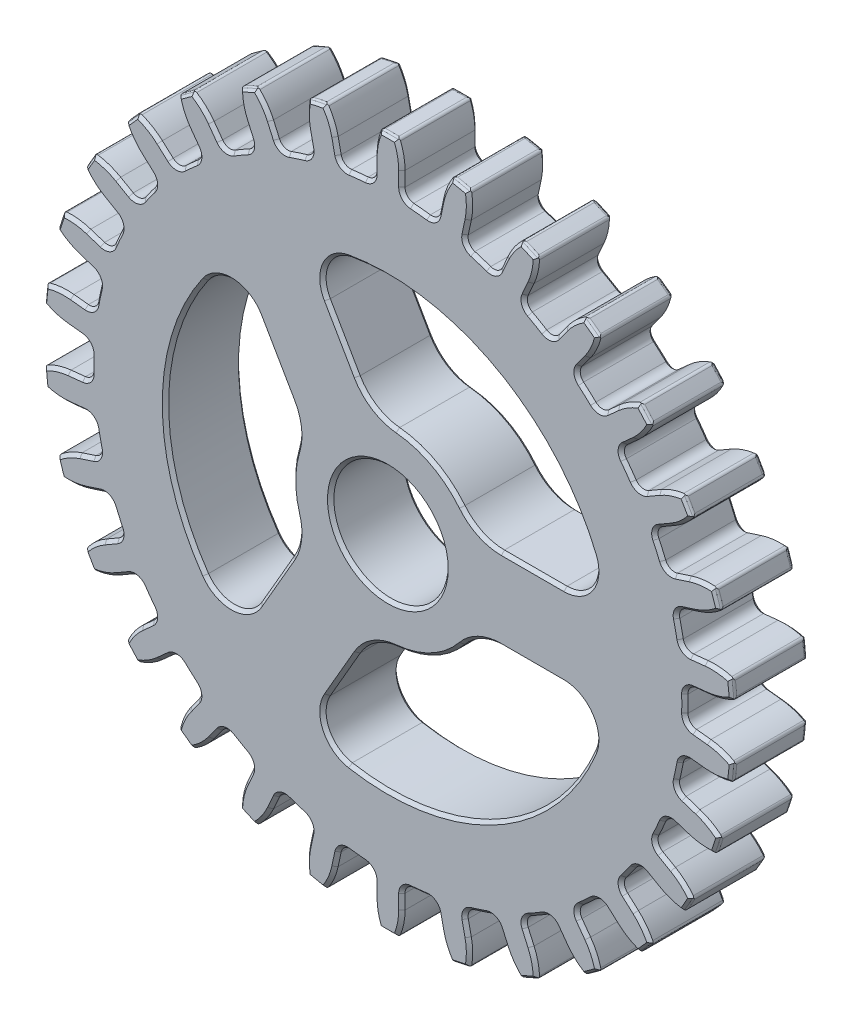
SolidWorks part; units mm, degrees
ref_plane "Спереди" through (0, 0, 0) normal (0, 0, 1) x (1, 0, 0)
ref_plane "Сверху" through (0, 0, 0) normal (0, 1, 0) x (1, 0, 0)
ref_plane "Справа" through (0, 0, 0) normal (1, 0, 0) x (0, 0, -1)
sketch "Эскиз1" plane through (0, 0, 0) normal (0, 0, 1) x (1, 0, 0)
  line L0 (0, 0) -> (27.2, 0) construction
  line L1 (0, 0) -> (0, 27.2) construction
  line L2 (8.9268, 3.25) -> (13.8542, 3.25)
  line L3 (8.9268, -3.25) -> (13.8542, -3.25)
  line L4 (-2.4255, -9.453) -> (-4.7744, -13.5213)
  line L5 (-7.5458, -5.3215) -> (-10.1442, -9.8222)
  line L6 (-7.5458, 5.3215) -> (-10.1442, 9.8222)
  line L7 (-2.4255, 9.453) -> (-4.7744, 13.5213)
  line L8 (0, 0) -> (-13.6, 23.5559) construction
  line L9 (-1.1, 25.2) -> (-1.1, 24.054)
  line L10 (1.1, 25.2) -> (1.1, 24.054)
  line L11 (4.1634, 24.878) -> (3.9251, 23.757)
  line L12 (6.3153, 24.4206) -> (6.0771, 23.2996)
  line L13 (9.2449, 23.4688) -> (8.7787, 22.4218)
  line L14 (11.2547, 22.5739) -> (10.7885, 21.527)
  line L15 (13.9223, 21.0338) -> (13.2486, 20.1066)
  line L16 (15.7021, 19.7407) -> (15.0285, 18.8135)
  line L17 (17.9912, 17.6796) -> (17.1395, 16.9127)
  line L18 (19.4633, 16.0446) -> (18.6116, 15.2778)
  line L19 (21.2738, 13.5526) -> (20.2813, 12.9796)
  line L20 (22.3738, 11.6474) -> (21.3813, 11.0744)
  line L21 (23.6267, 8.8334) -> (22.5368, 8.4792)
  line L22 (24.3065, 6.7411) -> (23.2166, 6.3869)
  line L23 (24.947, 3.7281) -> (23.8072, 3.6083)
  line L24 (25.1769, 1.5401) -> (24.0372, 1.4203)
  line L25 (25.1769, -1.5401) -> (24.0372, -1.4203)
  line L26 (24.947, -3.7281) -> (23.8072, -3.6083)
  line L27 (24.3065, -6.7411) -> (23.2166, -6.3869)
  line L28 (23.6267, -8.8334) -> (22.5368, -8.4792)
  line L29 (22.3738, -11.6474) -> (21.3813, -11.0744)
  line L30 (21.2738, -13.5526) -> (20.2813, -12.9796)
  line L31 (19.4633, -16.0446) -> (18.6116, -15.2778)
  line L32 (17.9912, -17.6796) -> (17.1395, -16.9127)
  line L33 (15.7021, -19.7407) -> (15.0285, -18.8135)
  line L34 (13.9223, -21.0338) -> (13.2486, -20.1066)
  line L35 (11.2547, -22.5739) -> (10.7885, -21.527)
  line L36 (9.2449, -23.4688) -> (8.7787, -22.4218)
  line L37 (6.3153, -24.4206) -> (6.0771, -23.2996)
  line L38 (4.1634, -24.878) -> (3.9251, -23.757)
  line L39 (1.1, -25.2) -> (1.1, -24.054)
  line L40 (-1.1, -25.2) -> (-1.1, -24.054)
  line L41 (-4.1634, -24.878) -> (-3.9251, -23.757)
  line L42 (-6.3153, -24.4206) -> (-6.0771, -23.2996)
  line L43 (-9.2449, -23.4688) -> (-8.7787, -22.4218)
  line L44 (-11.2547, -22.5739) -> (-10.7885, -21.527)
  line L45 (-13.9223, -21.0338) -> (-13.2486, -20.1066)
  line L46 (-15.7021, -19.7407) -> (-15.0285, -18.8135)
  line L47 (-17.9912, -17.6796) -> (-17.1395, -16.9127)
  line L48 (-19.4633, -16.0446) -> (-18.6116, -15.2778)
  line L49 (-21.2738, -13.5526) -> (-20.2813, -12.9796)
  line L50 (-22.3738, -11.6474) -> (-21.3813, -11.0744)
  line L51 (-23.6267, -8.8334) -> (-22.5368, -8.4792)
  line L52 (-24.3065, -6.7411) -> (-23.2166, -6.3869)
  line L53 (-24.947, -3.7281) -> (-23.8072, -3.6083)
  line L54 (-25.1769, -1.5401) -> (-24.0372, -1.4203)
  line L55 (-25.1769, 1.5401) -> (-24.0372, 1.4203)
  line L56 (-24.947, 3.7281) -> (-23.8072, 3.6083)
  line L57 (-24.3065, 6.7411) -> (-23.2166, 6.3869)
  line L58 (-23.6267, 8.8334) -> (-22.5368, 8.4792)
  line L59 (-22.3738, 11.6474) -> (-21.3813, 11.0744)
  line L60 (-21.2738, 13.5526) -> (-20.2813, 12.9796)
  line L61 (-19.4633, 16.0446) -> (-18.6116, 15.2778)
  line L62 (-17.9912, 17.6796) -> (-17.1395, 16.9127)
  line L63 (-15.7021, 19.7407) -> (-15.0285, 18.8135)
  line L64 (-13.9223, 21.0338) -> (-13.2486, 20.1066)
  line L65 (-11.2547, 22.5739) -> (-10.7885, 21.527)
  line L66 (-9.2449, 23.4688) -> (-8.7787, 22.4218)
  line L67 (-6.3153, 24.4206) -> (-6.0771, 23.2996)
  line L68 (-4.1634, 24.878) -> (-3.9251, 23.757)
  arc A0 (-13.6, 23.5559) -> (27.1141, -2.1597) centre (0, 0) ccw
  circle A1 centre (0, 0) radius 25.5 construction
  arc A2 (-1.7925, 23.3062) -> (-3.0923, 23.1696) centre (0, 0) ccw
  circle A3 centre (0, 0) radius 4.5
  arc A4 (5.8218, 4.7283) -> (0.6773, 7.4694) centre (0, 0) ccw
  arc A5 (16.1632, 6.7083) -> (-3.0442, 17.2332) centre (0, 0) ccw
  arc A6 (-14.3608, 10.0008) -> (-14.3608, -10.0008) centre (0, 0) ccw
  arc A7 (-3.0442, -17.2332) -> (16.1632, -6.7083) centre (0, 0) ccw
  arc A8 (0.6773, -7.4694) -> (5.8218, -4.7283) centre (0, 0) ccw
  arc A9 (-7.1804, 2.1662) -> (-7.1804, -2.1662) centre (0, 0) ccw
  arc A10 (-7.5458, 5.3215) -> (-7.1804, 2.1662) centre (-11.0099, 3.3215) cw
  arc A11 (-7.5458, -5.3215) -> (-7.1804, -2.1662) centre (-11.0099, -3.3215) ccw
  arc A12 (-2.4255, -9.453) -> (0.6773, -7.4694) centre (1.0386, -11.453) cw
  arc A13 (8.9268, -3.25) -> (5.8218, -4.7283) centre (8.9268, -7.25) ccw
  arc A14 (8.9268, 3.25) -> (5.8218, 4.7283) centre (8.9268, 7.25) cw
  arc A15 (-2.4255, 9.453) -> (0.6773, 7.4694) centre (1.0386, 11.453) ccw
  arc A16 (-10.1442, -9.8222) -> (-14.3608, -10.0008) centre (-12.3093, -8.5722) cw
  arc A17 (-4.7744, -13.5213) -> (-3.0442, -17.2332) centre (-2.6093, -14.7713) ccw
  arc A18 (13.8542, -3.25) -> (16.1632, -6.7083) centre (13.8542, -5.75) cw
  arc A19 (13.8542, 3.25) -> (16.1632, 6.7083) centre (13.8542, 5.75) ccw
  arc A20 (-4.7744, 13.5213) -> (-3.0442, 17.2332) centre (-2.6093, 14.7713) cw
  arc A21 (-10.1442, 9.8222) -> (-14.3608, 10.0008) centre (-12.3093, 8.5722) ccw
  arc A22 (-0.6863, 27.1913) -> (-1.1, 25.2) centre (3.9, 25.2) ccw
  arc A23 (0.6863, 27.1913) -> (1.1, 25.2) centre (-3.9, 25.2) cw
  arc A24 (0.6863, 27.1913) -> (-0.6863, 27.1913) centre (0, 0) ccw
  arc A25 (4.982, 26.7398) -> (4.1634, 24.878) centre (9.0542, 23.8385) ccw
  arc A26 (6.3247, 26.4544) -> (4.982, 26.7398) centre (0, 0) ccw
  arc A27 (6.3247, 26.4544) -> (6.3153, 24.4206) centre (1.4246, 25.4602) cw
  arc A28 (10.4327, 25.1197) -> (9.2449, 23.4688) centre (13.8126, 21.4351) ccw
  arc A29 (11.6867, 24.5614) -> (10.4327, 25.1197) centre (0, 0) ccw
  arc A30 (11.6867, 24.5614) -> (11.2547, 22.5739) centre (6.6869, 24.6076) cw
  arc A31 (15.4274, 22.4017) -> (13.9223, 21.0338) centre (17.9674, 18.0949) ccw
  arc A32 (16.5379, 21.5948) -> (15.4274, 22.4017) centre (0, 0) ccw
  arc A33 (16.5379, 21.5948) -> (15.7021, 19.7407) centre (11.657, 22.6796) cw
  arc A34 (19.7478, 18.7046) -> (17.9912, 17.6796) centre (21.3369, 13.9638) ccw
  arc A35 (20.6664, 17.6845) -> (19.7478, 18.7046) centre (0, 0) ccw
  arc A36 (20.6664, 17.6845) -> (19.4633, 16.0446) centre (16.1176, 19.7604) cw
  arc A37 (23.2052, 14.1901) -> (21.2738, 13.5526) centre (23.7738, 9.2225) ccw
  arc A38 (23.8916, 13.0013) -> (23.2052, 14.1901) centre (0, 0) ccw
  arc A39 (23.8916, 13.0013) -> (22.3738, 11.6474) centre (19.8738, 15.9775) cw
  arc A40 (25.6484, 9.0553) -> (23.6267, 8.8334) centre (25.1718, 4.0781) ccw
  arc A41 (26.0726, 7.7498) -> (25.6484, 9.0553) centre (0, 0) ccw
  arc A42 (26.0726, 7.7498) -> (24.3065, 6.7411) centre (22.7615, 11.4963) cw
  arc A43 (26.9706, 3.5249) -> (24.947, 3.7281) centre (25.4696, -1.2445) ccw
  arc A44 (27.1141, 2.1597) -> (26.9706, 3.5249) centre (0, 0) ccw
  arc A45 (27.1141, 2.1597) -> (25.1769, 1.5401) centre (24.6543, 6.5128) cw
  arc A46 (27.1141, -2.1597) -> (25.1769, -1.5401) centre (24.6543, -6.5128) ccw
  arc A47 (26.9706, -3.5249) -> (27.1141, -2.1597) centre (0, 0) ccw
  arc A48 (26.9706, -3.5249) -> (24.947, -3.7281) centre (25.4696, 1.2445) cw
  arc A49 (26.0726, -7.7498) -> (24.3065, -6.7411) centre (22.7615, -11.4963) ccw
  arc A50 (25.6484, -9.0553) -> (26.0726, -7.7498) centre (0, 0) ccw
  arc A51 (25.6484, -9.0553) -> (23.6267, -8.8334) centre (25.1718, -4.0781) cw
  arc A52 (23.8916, -13.0013) -> (22.3738, -11.6474) centre (19.8738, -15.9775) ccw
  arc A53 (23.2052, -14.1901) -> (23.8916, -13.0013) centre (0, 0) ccw
  arc A54 (23.2052, -14.1901) -> (21.2738, -13.5526) centre (23.7738, -9.2225) cw
  arc A55 (20.6664, -17.6845) -> (19.4633, -16.0446) centre (16.1176, -19.7604) ccw
  arc A56 (19.7478, -18.7046) -> (20.6664, -17.6845) centre (0, 0) ccw
  arc A57 (19.7478, -18.7046) -> (17.9912, -17.6796) centre (21.3369, -13.9638) cw
  arc A58 (16.5379, -21.5948) -> (15.7021, -19.7407) centre (11.657, -22.6796) ccw
  arc A59 (15.4274, -22.4017) -> (16.5379, -21.5948) centre (0, 0) ccw
  arc A60 (15.4274, -22.4017) -> (13.9223, -21.0338) centre (17.9674, -18.0949) cw
  arc A61 (11.6867, -24.5614) -> (11.2547, -22.5739) centre (6.6869, -24.6076) ccw
  arc A62 (10.4327, -25.1197) -> (11.6867, -24.5614) centre (0, 0) ccw
  arc A63 (10.4327, -25.1197) -> (9.2449, -23.4688) centre (13.8126, -21.4351) cw
  arc A64 (6.3247, -26.4544) -> (6.3153, -24.4206) centre (1.4246, -25.4602) ccw
  arc A65 (4.982, -26.7398) -> (6.3247, -26.4544) centre (0, 0) ccw
  arc A66 (4.982, -26.7398) -> (4.1634, -24.878) centre (9.0542, -23.8385) cw
  arc A67 (0.6863, -27.1913) -> (1.1, -25.2) centre (-3.9, -25.2) ccw
  arc A68 (-0.6863, -27.1913) -> (0.6863, -27.1913) centre (0, 0) ccw
  arc A69 (-0.6863, -27.1913) -> (-1.1, -25.2) centre (3.9, -25.2) cw
  arc A70 (-4.982, -26.7398) -> (-4.1634, -24.878) centre (-9.0542, -23.8385) ccw
  arc A71 (-6.3247, -26.4544) -> (-4.982, -26.7398) centre (0, 0) ccw
  arc A72 (-6.3247, -26.4544) -> (-6.3153, -24.4206) centre (-1.4246, -25.4602) cw
  arc A73 (-10.4327, -25.1197) -> (-9.2449, -23.4688) centre (-13.8126, -21.4351) ccw
  arc A74 (-11.6867, -24.5614) -> (-10.4327, -25.1197) centre (0, 0) ccw
  arc A75 (-11.6867, -24.5614) -> (-11.2547, -22.5739) centre (-6.6869, -24.6076) cw
  arc A76 (-15.4274, -22.4017) -> (-13.9223, -21.0338) centre (-17.9674, -18.0949) ccw
  arc A77 (-16.5379, -21.5948) -> (-15.4274, -22.4017) centre (0, 0) ccw
  arc A78 (-16.5379, -21.5948) -> (-15.7021, -19.7407) centre (-11.657, -22.6796) cw
  arc A79 (-19.7478, -18.7046) -> (-17.9912, -17.6796) centre (-21.3369, -13.9638) ccw
  arc A80 (-20.6664, -17.6845) -> (-19.7478, -18.7046) centre (0, 0) ccw
  arc A81 (-20.6664, -17.6845) -> (-19.4633, -16.0446) centre (-16.1176, -19.7604) cw
  arc A82 (-23.2052, -14.1901) -> (-21.2738, -13.5526) centre (-23.7738, -9.2225) ccw
  arc A83 (-23.8916, -13.0013) -> (-23.2052, -14.1901) centre (0, 0) ccw
  arc A84 (-23.8916, -13.0013) -> (-22.3738, -11.6474) centre (-19.8738, -15.9775) cw
  arc A85 (-25.6484, -9.0553) -> (-23.6267, -8.8334) centre (-25.1718, -4.0781) ccw
  arc A86 (-26.0726, -7.7498) -> (-25.6484, -9.0553) centre (0, 0) ccw
  arc A87 (-26.0726, -7.7498) -> (-24.3065, -6.7411) centre (-22.7615, -11.4963) cw
  arc A88 (-26.9706, -3.5249) -> (-24.947, -3.7281) centre (-25.4696, 1.2445) ccw
  arc A89 (-27.1141, -2.1597) -> (-26.9706, -3.5249) centre (0, 0) ccw
  arc A90 (-27.1141, -2.1597) -> (-25.1769, -1.5401) centre (-24.6543, -6.5128) cw
  arc A91 (-27.1141, 2.1597) -> (-25.1769, 1.5401) centre (-24.6543, 6.5128) ccw
  arc A92 (-26.9706, 3.5249) -> (-27.1141, 2.1597) centre (0, 0) ccw
  arc A93 (-26.9706, 3.5249) -> (-24.947, 3.7281) centre (-25.4696, -1.2445) cw
  arc A94 (-26.0726, 7.7498) -> (-24.3065, 6.7411) centre (-22.7615, 11.4963) ccw
  arc A95 (-25.6484, 9.0553) -> (-26.0726, 7.7498) centre (0, 0) ccw
  arc A96 (-25.6484, 9.0553) -> (-23.6267, 8.8334) centre (-25.1718, 4.0781) cw
  arc A97 (-23.8916, 13.0013) -> (-22.3738, 11.6474) centre (-19.8738, 15.9775) ccw
  arc A98 (-23.2052, 14.1901) -> (-23.8916, 13.0013) centre (0, 0) ccw
  arc A99 (-23.2052, 14.1901) -> (-21.2738, 13.5526) centre (-23.7738, 9.2225) cw
  arc A100 (-20.6664, 17.6845) -> (-19.4633, 16.0446) centre (-16.1176, 19.7604) ccw
  arc A101 (-19.7478, 18.7046) -> (-20.6664, 17.6845) centre (0, 0) ccw
  arc A102 (-19.7478, 18.7046) -> (-17.9912, 17.6796) centre (-21.3369, 13.9638) cw
  arc A103 (-16.5379, 21.5948) -> (-15.7021, 19.7407) centre (-11.657, 22.6796) ccw
  arc A104 (-15.4274, 22.4017) -> (-16.5379, 21.5948) centre (0, 0) ccw
  arc A105 (-15.4274, 22.4017) -> (-13.9223, 21.0338) centre (-17.9674, 18.0949) cw
  arc A106 (-11.6867, 24.5614) -> (-11.2547, 22.5739) centre (-6.6869, 24.6076) ccw
  arc A107 (-10.4327, 25.1197) -> (-11.6867, 24.5614) centre (0, 0) ccw
  arc A108 (-10.4327, 25.1197) -> (-9.2449, 23.4688) centre (-13.8126, 21.4351) cw
  arc A109 (-6.3247, 26.4544) -> (-6.3153, 24.4206) centre (-1.4246, 25.4602) ccw
  arc A110 (-4.982, 26.7398) -> (-6.3247, 26.4544) centre (0, 0) ccw
  arc A111 (-4.982, 26.7398) -> (-4.1634, 24.878) centre (-9.0542, 23.8385) cw
  arc A112 (3.0923, 23.1696) -> (1.7925, 23.3062) centre (0, 0) ccw
  arc A113 (-6.5989, 22.4242) -> (-7.842, 22.0203) centre (0, 0) ccw
  arc A114 (-11.117, 20.5622) -> (-12.2489, 19.9087) centre (0, 0) ccw
  arc A115 (7.842, 22.0203) -> (6.5989, 22.4242) centre (0, 0) ccw
  arc A116 (12.2489, 19.9087) -> (11.117, 20.5622) centre (0, 0) ccw
  arc A117 (16.1205, 16.9269) -> (15.1492, 17.8015) centre (0, 0) ccw
  arc A118 (19.2875, 13.2054) -> (18.5193, 14.2628) centre (0, 0) ccw
  arc A119 (21.6116, 8.9068) -> (21.08, 10.1007) centre (0, 0) ccw
  arc A120 (22.9911, 4.2188) -> (22.7194, 5.4972) centre (0, 0) ccw
  arc A121 (23.3659, -0.6535) -> (23.3659, 0.6535) centre (0, 0) ccw
  arc A122 (22.7194, -5.4972) -> (22.9911, -4.2188) centre (0, 0) ccw
  arc A123 (21.08, -10.1007) -> (21.6116, -8.9068) centre (0, 0) ccw
  arc A124 (18.5193, -14.2628) -> (19.2875, -13.2054) centre (0, 0) ccw
  arc A125 (15.1492, -17.8015) -> (16.1205, -16.9269) centre (0, 0) ccw
  arc A126 (11.117, -20.5622) -> (12.2489, -19.9087) centre (0, 0) ccw
  arc A127 (6.5989, -22.4242) -> (7.842, -22.0203) centre (0, 0) ccw
  arc A128 (1.7925, -23.3062) -> (3.0923, -23.1696) centre (0, 0) ccw
  arc A129 (-3.0923, -23.1696) -> (-1.7925, -23.3062) centre (0, 0) ccw
  arc A130 (-7.842, -22.0203) -> (-6.5989, -22.4242) centre (0, 0) ccw
  arc A131 (-12.2489, -19.9087) -> (-11.117, -20.5622) centre (0, 0) ccw
  arc A132 (-16.1205, -16.9269) -> (-15.1492, -17.8015) centre (0, 0) ccw
  arc A133 (-19.2875, -13.2054) -> (-18.5193, -14.2628) centre (0, 0) ccw
  arc A134 (-21.6116, -8.9068) -> (-21.08, -10.1007) centre (0, 0) ccw
  arc A135 (-22.9911, -4.2188) -> (-22.7194, -5.4972) centre (0, 0) ccw
  arc A136 (-23.3659, 0.6535) -> (-23.3659, -0.6535) centre (0, 0) ccw
  arc A137 (-22.7194, 5.4972) -> (-22.9911, 4.2188) centre (0, 0) ccw
  arc A138 (-21.08, 10.1007) -> (-21.6116, 8.9068) centre (0, 0) ccw
  arc A139 (-18.5193, 14.2628) -> (-19.2875, 13.2054) centre (0, 0) ccw
  arc A140 (-15.1492, 17.8015) -> (-16.1205, 16.9269) centre (0, 0) ccw
  arc A141 (23.8072, 3.6083) -> (22.9911, 4.2188) centre (23.7288, 4.3542) cw
  arc A142 (23.2166, 6.3869) -> (22.7194, 5.4972) centre (23.4484, 5.6736) ccw
  arc A143 (24.0372, 1.4203) -> (23.3659, 0.6535) centre (24.1156, 0.6745) ccw
  arc A144 (24.0372, -1.4203) -> (23.3659, -0.6535) centre (24.1156, -0.6745) cw
  arc A145 (23.2166, -6.3869) -> (22.7194, -5.4972) centre (23.4484, -5.6736) cw
  arc A146 (23.8072, -3.6083) -> (22.9911, -4.2188) centre (23.7288, -4.3542) ccw
  arc A147 (22.5368, -8.4792) -> (21.6116, -8.9068) centre (22.305, -9.1925) ccw
  arc A148 (21.3813, -11.0744) -> (21.08, -10.1007) centre (21.7563, -10.4248) cw
  arc A149 (20.2813, -12.9796) -> (19.2875, -13.2054) centre (19.9063, -13.6291) ccw
  arc A150 (18.6116, -15.2778) -> (18.5193, -14.2628) centre (19.1135, -14.7204) cw
  arc A151 (15.0285, -18.8135) -> (15.1492, -17.8015) centre (15.6352, -18.3727) cw
  arc A152 (17.1395, -16.9127) -> (16.1205, -16.9269) centre (16.6377, -17.4701) ccw
  arc A153 (13.2486, -20.1066) -> (12.2489, -19.9087) centre (12.6419, -20.5475) ccw
  arc A154 (10.7885, -21.527) -> (11.117, -20.5622) centre (11.4737, -21.2219) cw
  arc A155 (8.7787, -22.4218) -> (7.842, -22.0203) centre (8.0936, -22.7269) ccw
  arc A156 (6.0771, -23.2996) -> (6.5989, -22.4242) centre (6.8107, -23.1437) cw
  arc A157 (3.9251, -23.757) -> (3.0923, -23.1696) centre (3.1915, -23.913) ccw
  arc A158 (1.1, -24.054) -> (1.7925, -23.3062) centre (1.85, -24.054) cw
  arc A159 (-1.1, -24.054) -> (-1.7925, -23.3062) centre (-1.85, -24.054) ccw
  arc A160 (-3.9251, -23.757) -> (-3.0923, -23.1696) centre (-3.1915, -23.913) cw
  arc A161 (-6.0771, -23.2996) -> (-6.5989, -22.4242) centre (-6.8107, -23.1437) ccw
  arc A162 (-8.7787, -22.4218) -> (-7.842, -22.0203) centre (-8.0936, -22.7269) cw
  arc A163 (-10.7885, -21.527) -> (-11.117, -20.5622) centre (-11.4737, -21.2219) ccw
  arc A164 (-13.2486, -20.1066) -> (-12.2489, -19.9087) centre (-12.6419, -20.5475) cw
  arc A165 (-15.0285, -18.8135) -> (-15.1492, -17.8015) centre (-15.6352, -18.3727) ccw
  arc A166 (-17.1395, -16.9127) -> (-16.1205, -16.9269) centre (-16.6377, -17.4701) cw
  arc A167 (-18.6116, -15.2778) -> (-18.5193, -14.2628) centre (-19.1135, -14.7204) ccw
  arc A168 (-20.2813, -12.9796) -> (-19.2875, -13.2054) centre (-19.9063, -13.6291) cw
  arc A169 (-21.3813, -11.0744) -> (-21.08, -10.1007) centre (-21.7563, -10.4248) ccw
  arc A170 (-22.5368, -8.4792) -> (-21.6116, -8.9068) centre (-22.305, -9.1925) cw
  arc A171 (-23.2166, -6.3869) -> (-22.7194, -5.4972) centre (-23.4484, -5.6736) ccw
  arc A172 (-23.8072, -3.6083) -> (-22.9911, -4.2188) centre (-23.7288, -4.3542) cw
  arc A173 (-24.0372, -1.4203) -> (-23.3659, -0.6535) centre (-24.1156, -0.6745) ccw
  arc A174 (-24.0372, 1.4203) -> (-23.3659, 0.6535) centre (-24.1156, 0.6745) cw
  arc A175 (-23.8072, 3.6083) -> (-22.9911, 4.2188) centre (-23.7288, 4.3542) ccw
  arc A176 (-23.2166, 6.3869) -> (-22.7194, 5.4972) centre (-23.4484, 5.6736) cw
  arc A177 (-22.5368, 8.4792) -> (-21.6116, 8.9068) centre (-22.305, 9.1925) ccw
  arc A178 (-21.3813, 11.0744) -> (-21.08, 10.1007) centre (-21.7563, 10.4248) cw
  arc A179 (-20.2813, 12.9796) -> (-19.2875, 13.2054) centre (-19.9063, 13.6291) ccw
  arc A180 (-10.7885, 21.527) -> (-11.117, 20.5622) centre (-11.4737, 21.2219) cw
  arc A181 (-18.6116, 15.2778) -> (-18.5193, 14.2628) centre (-19.1135, 14.7204) cw
  arc A182 (-17.1395, 16.9127) -> (-16.1205, 16.9269) centre (-16.6377, 17.4701) ccw
  arc A183 (-15.0285, 18.8135) -> (-15.1492, 17.8015) centre (-15.6352, 18.3727) cw
  arc A184 (-13.2486, 20.1066) -> (-12.2489, 19.9087) centre (-12.6419, 20.5475) ccw
  arc A185 (22.5368, 8.4792) -> (21.6116, 8.9068) centre (22.305, 9.1925) cw
  arc A186 (21.3813, 11.0744) -> (21.08, 10.1007) centre (21.7563, 10.4248) ccw
  arc A187 (20.2813, 12.9796) -> (19.2875, 13.2054) centre (19.9063, 13.6291) cw
  arc A188 (18.6116, 15.2778) -> (18.5193, 14.2628) centre (19.1135, 14.7204) ccw
  arc A189 (17.1395, 16.9127) -> (16.1205, 16.9269) centre (16.6377, 17.4701) cw
  arc A190 (15.0285, 18.8135) -> (15.1492, 17.8015) centre (15.6352, 18.3727) ccw
  arc A191 (13.2486, 20.1066) -> (12.2489, 19.9087) centre (12.6419, 20.5475) cw
  arc A192 (10.7885, 21.527) -> (11.117, 20.5622) centre (11.4737, 21.2219) ccw
  arc A193 (8.7787, 22.4218) -> (7.842, 22.0203) centre (8.0936, 22.7269) cw
  arc A194 (6.0771, 23.2996) -> (6.5989, 22.4242) centre (6.8107, 23.1437) ccw
  arc A195 (3.9251, 23.757) -> (3.0923, 23.1696) centre (3.1915, 23.913) cw
  arc A196 (1.1, 24.054) -> (1.7925, 23.3062) centre (1.85, 24.054) ccw
  arc A197 (-1.1, 24.054) -> (-1.7925, 23.3062) centre (-1.85, 24.054) cw
  arc A198 (-3.9251, 23.757) -> (-3.0923, 23.1696) centre (-3.1915, 23.913) ccw
  arc A199 (-6.0771, 23.2996) -> (-6.5989, 22.4242) centre (-6.8107, 23.1437) cw
  arc A200 (-8.7787, 22.4218) -> (-7.842, 22.0203) centre (-8.0936, 22.7269) ccw
  point P14 (-6.566, 3.6246)
  point P29 (6.7593, -3.25)
  point P32 (6.7593, 3.25)
  point P41 (17.1956, -3.25)
  point P44 (17.1956, 3.25)
  point P429 (1.1, 23.3491)
  point P432 (-1.1, 23.3491)
  dimension "D1" = 54.4
  dimension "D2" = 51
  dimension "D3" = 46.75
  dimension "D4" = 9
  dimension "D5" = 15
  dimension "D6" = 35
  dimension "D9" = 4
  dimension "D10" = 2.5
  dimension "D12" = 10
  dimension "D15" = 0.75
  dimension "D7" = 6.5
  dimension "D11" = 120
  dimension "D13" = 2.2
  dimension "D14" = 30
  dimension "D8" = 3
extrude "Бобышка-Вытянуть1" add sketch "Эскиз1" along normal blind 6 contours A200 L66 A108 A107 A106 L65 A180 A114 A184 L64 A105 A0 A103 L63 A183 A140 A182 L62 A102 A100 L61 A181 A139 A179 L60 A99 A97 L59 A178 A138 A177 L58 A96 A94 L57 A176 A137 A175 L56 A93 A91 L55 A174 A136 A173 L54 A90
chamfer "Фаска1" distance 0.25 angle 45 400 edges at (-8.845, 7.5718, 0) (-7.0364, 3.7817, 0) (-7.5, 0, 0) (-7.0364, -3.7817, 0) (-8.845, -7.5718, 0) (-12.2034, -11.0699, 0) (-17.5, 0, 0) (-12.2034, 11.0699, 0) (15.9333, -4.3618, 0) (8.4095, -15.347, 0) (-4.8752, -15.8275, 0) (-3.5999, -11.4872, 0) (-1.116, -8.0828, 0) (3.5268, -6.6191, 0) (7.2073, -3.6384, 0) (11.3905, -3.25, 0) (4.5, 0, 0) (-4.8752, 15.8275, 0) (8.4095, 15.347, 0) (15.9333, 4.3618, 0) (11.3905, 3.25, 0) (7.2073, 3.6384, 0) (3.5268, 6.6191, 0) (-1.116, 8.0828, 0) (-3.5999, 11.4872, 0) (-9.0118, 22.9453, 0) (-9.754, 24.3553, 0) (-11.0632, 24.8484, 0) (-11.5728, 23.5454, 0) (-11.0216, 22.0505, 0) (-10.7637, 20.9802, 0) (-11.6875, 20.2433, 0) (-12.7875, 19.8117, 0) (-13.5855, 20.5702, 0) (-14.6045, 21.7951, 0) (-15.9878, 22.0053, 0) (-16.2153, 20.6248, 0) (-15.3653, 19.2771, 0) (-14.8905, 18.2838, 0) (-15.6409, 17.371, 0) (-16.6272, 16.7201, 0) (-17.5654, 17.2961, 0) (-18.8169, 18.2823, 0) (-20.2135, 18.2004, 0) (-20.1491, 16.8028, 0) (-19.0375, 15.6612, 0) (-18.3666, 14.7884, 0) (-18.9108, 13.7395, 0) (-19.7402, 12.8978, 0) (-20.7776, 13.2661, 0) (-22.2068, 13.9706, 0) (-23.5559, 13.6, 0) (-23.2023, 12.2463, 0) (-21.8776, 11.3609, 0) (-21.0399, 10.6466, 0) (-21.3541, 9.5075, 0) (-21.9904, 8.5117, 0) (-23.0817, 8.6563, 0) (-24.6262, 9.0482, 0) (-25.8687, 8.4053, 0) (-25.2414, 7.1547, 0) (-23.7616, 6.564, 0) (-22.7937, 6.0395, 0) (-22.8642, 4.8599, 0) (-23.2795, 3.7536, 0) (-24.3771, 3.6682, 0) (-25.9692, 3.7305, 0) (-27.051, 2.8432, 0) (-26.1774, 1.7504, 0) (-24.6071, 1.4802, 0) (-23.5513, 1.1685, 0) (-23.375, 0, 0) (-23.5513, -1.1685, 0) (-24.6071, -1.4802, 0) (-26.1774, -1.7504, 0) (-27.051, -2.8432, 0) (-25.9692, -3.7305, 0) (-24.3771, -3.6682, 0) (-23.2795, -3.7536, 0) (-22.8642, -4.8599, 0) (-22.7937, -6.0395, 0) (-23.7616, -6.564, 0) (-25.2414, -7.1547, 0) (-25.8687, -8.4053, 0) (-24.6262, -9.0482, 0) (-23.0817, -8.6563, 0) (-21.9904, -8.5117, 0) (-21.3541, -9.5075, 0) (-21.0399, -10.6466, 0) (-21.8776, -11.3609, 0) (-23.2023, -12.2463, 0) (-23.5559, -13.6, 0) (-22.2068, -13.9706, 0) (-20.7776, -13.2661, 0) (-19.7402, -12.8978, 0) (-18.9108, -13.7395, 0) (-18.3666, -14.7884, 0) (-19.0375, -15.6612, 0) (-20.1491, -16.8028, 0) (-20.2135, -18.2004, 0) (-18.8169, -18.2823, 0) (-17.5654, -17.2961, 0) (-16.6272, -16.7201, 0) (-15.6409, -17.371, 0) (-14.8905, -18.2838, 0) (-15.3653, -19.2771, 0) (-16.2153, -20.6248, 0) (-15.9878, -22.0053, 0) (-14.6045, -21.7951, 0) (-13.5855, -20.5702, 0) (-12.7875, -19.8117, 0) (-11.6875, -20.2433, 0) (-10.7637, -20.9802, 0) (-11.0216, -22.0505, 0) (-11.5728, -23.5454, 0) (-11.0632, -24.8484, 0) (-9.754, -24.3553, 0) (-9.0118, -22.9453, 0) (-8.389, -22.0375, 0) (-7.2233, -22.2309, 0) (-6.1665, -22.7596, 0) (-6.1962, -23.8601, 0) (-6.4245, -25.437, 0) (-5.6552, -26.6056, 0) (-4.4771, -25.851, 0) (-4.0443, -24.3175, 0) (-3.6238, -23.3001, 0) (-2.4434, -23.2469, 0) (-1.2997, -23.5444, 0) (-1.1, -24.627, 0) (-0.9955, -26.2169, 0) (0, -27.2, 0) (0.9955, -26.2169, 0) (1.1, -24.627, 0) (1.2997, -23.5444, 0) (2.4434, -23.2469, 0) (3.6238, -23.3001, 0) (4.0443, -24.3175, 0) (4.4771, -25.851, 0) (5.6552, -26.6056, 0) (6.4245, -25.437, 0) (6.1962, -23.8601, 0) (6.1665, -22.7596, 0) (7.2233, -22.2309, 0) (8.389, -22.0375, 0) (9.0118, -22.9453, 0) (9.754, -24.3553, 0) (11.0632, -24.8484, 0) (11.5728, -23.5454, 0) (11.0216, -22.0505, 0) (10.7637, -20.9802, 0) (11.6875, -20.2433, 0) (12.7875, -19.8117, 0) (13.5855, -20.5702, 0) (14.6045, -21.7951, 0) (15.9878, -22.0053, 0) (16.2153, -20.6248, 0) (15.3653, -19.2771, 0) (14.8905, -18.2838, 0) (15.6409, -17.371, 0) (16.6272, -16.7201, 0) (17.5654, -17.2961, 0) (18.8169, -18.2823, 0) (20.2135, -18.2004, 0) (20.1491, -16.8028, 0) (19.0375, -15.6612, 0) (18.3666, -14.7884, 0) (18.9108, -13.7395, 0) (19.7402, -12.8978, 0) (20.7776, -13.2661, 0) (22.2068, -13.9706, 0) (23.5559, -13.6, 0) (23.2023, -12.2463, 0) (21.8776, -11.3609, 0) (21.0399, -10.6466, 0) (21.3541, -9.5075, 0) (21.9904, -8.5117, 0) (23.0817, -8.6563, 0) (24.6262, -9.0482, 0) (25.8687, -8.4053, 0) (25.2414, -7.1547, 0) (23.7616, -6.564, 0) (22.7937, -6.0395, 0) (22.8642, -4.8599, 0) (23.2795, -3.7536, 0) (24.3771, -3.6682, 0) (25.9692, -3.7305, 0) (27.051, -2.8432, 0) (26.1774, -1.7504, 0) (24.6071, -1.4802, 0) (23.5513, -1.1685, 0) (23.375, 0, 0) (23.5513, 1.1685, 0) (24.6071, 1.4802, 0) (26.1774, 1.7504, 0) (27.051, 2.8432, 0) (25.9692, 3.7305, 0) (24.3771, 3.6682, 0) (23.2795, 3.7536, 0) (22.8642, 4.8599, 0) (22.7937, 6.0395, 0) (23.7616, 6.564, 0) (25.2414, 7.1547, 0) (25.8687, 8.4053, 0) (24.6262, 9.0482, 0) (23.0817, 8.6563, 0) (21.9904, 8.5117, 0) (21.3541, 9.5075, 0) (21.0399, 10.6466, 0) (21.8776, 11.3609, 0) (23.2023, 12.2463, 0) (23.5559, 13.6, 0) (22.2068, 13.9706, 0) (20.7776, 13.2661, 0) (19.7402, 12.8978, 0) (18.9108, 13.7395, 0) (18.3666, 14.7884, 0) (19.0375, 15.6612, 0) (20.1491, 16.8028, 0) (20.2135, 18.2004, 0) (18.8169, 18.2823, 0) (17.5654, 17.2961, 0) (16.6272, 16.7201, 0) (15.6409, 17.371, 0) (14.8905, 18.2838, 0) (15.3653, 19.2771, 0) (16.2153, 20.6248, 0) (15.9878, 22.0053, 0) (14.6045, 21.7951, 0) (13.5855, 20.5702, 0) (12.7875, 19.8117, 0) (11.6875, 20.2433, 0) (10.7637, 20.9802, 0) (11.0216, 22.0505, 0) (11.5728, 23.5454, 0) (11.0632, 24.8484, 0) (9.754, 24.3553, 0) (9.0118, 22.9453, 0) (8.389, 22.0375, 0) (7.2233, 22.2309, 0) (6.1665, 22.7596, 0) (6.1962, 23.8601, 0) (6.4245, 25.437, 0) (5.6552, 26.6056, 0) (4.4771, 25.851, 0) (4.0443, 24.3175, 0) (3.6238, 23.3001, 0) (2.4434, 23.2469, 0) (1.2997, 23.5444, 0) (1.1, 24.627, 0) (0.9955, 26.2169, 0) (0, 27.2, 0) (-0.9955, 26.2169, 0) (-1.1, 24.627, 0) (-1.2997, 23.5444, 0) (-2.4434, 23.2469, 0) (-3.6238, 23.3001, 0) (-4.0443, 24.3175, 0) (-4.4771, 25.851, 0) (-5.6552, 26.6056, 0) (-6.4245, 25.437, 0) (-6.1962, 23.8601, 0) (-6.1665, 22.7596, 0) (-7.2233, 22.2309, 0) (-8.389, 22.0375, 0) (-17.5, 0, 6) (-12.2034, -11.0699, 6) (-8.845, -7.5718, 6) (-7.0364, -3.7817, 6) (-7.5, 0, 6) (-7.0364, 3.7817, 6) (-8.845, 7.5718, 6) (-12.2034, 11.0699, 6) (7.2073, -3.6384, 6) (3.5268, -6.6191, 6) (-1.116, -8.0828, 6) (-3.5999, -11.4872, 6) (-4.8752, -15.8275, 6) (8.4095, -15.347, 6) (15.9333, -4.3618, 6) (11.3905, -3.25, 6) (4.5, 0, 6) (-1.116, 8.0828, 6) (3.5268, 6.6191, 6) (7.2073, 3.6384, 6) (11.3905, 3.25, 6) (15.9333, 4.3618, 6) (8.4095, 15.347, 6) (-4.8752, 15.8275, 6) (-3.5999, 11.4872, 6) (-7.2233, 22.2309, 6) (-6.1665, 22.7596, 6) (-6.1962, 23.8601, 6) (-6.4245, 25.437, 6) (-5.6552, 26.6056, 6) (-4.4771, 25.851, 6) (-4.0443, 24.3175, 6) (-3.6238, 23.3001, 6) (-2.4434, 23.2469, 6) (-1.2997, 23.5444, 6) (-1.1, 24.627, 6) (-0.9955, 26.2169, 6) (0, 27.2, 6) (0.9955, 26.2169, 6) (1.1, 24.627, 6) (1.2997, 23.5444, 6) (2.4434, 23.2469, 6) (3.6238, 23.3001, 6) (4.0443, 24.3175, 6) (4.4771, 25.851, 6) (5.6552, 26.6056, 6) (6.4245, 25.437, 6) (6.1962, 23.8601, 6) (6.1665, 22.7596, 6) (7.2233, 22.2309, 6) (8.389, 22.0375, 6) (9.0118, 22.9453, 6) (9.754, 24.3553, 6) (11.0632, 24.8484, 6) (11.5728, 23.5454, 6) (11.0216, 22.0505, 6) (10.7637, 20.9802, 6) (11.6875, 20.2433, 6) (12.7875, 19.8117, 6) (13.5855, 20.5702, 6) (14.6045, 21.7951, 6) (15.9878, 22.0053, 6) (16.2153, 20.6248, 6) (15.3653, 19.2771, 6) (14.8905, 18.2838, 6) (15.6409, 17.371, 6) (16.6272, 16.7201, 6) (17.5654, 17.2961, 6) (18.8169, 18.2823, 6) (20.2135, 18.2004, 6) (20.1491, 16.8028, 6) (19.0375, 15.6612, 6) (18.3666, 14.7884, 6) (18.9108, 13.7395, 6) (19.7402, 12.8978, 6) (20.7776, 13.2661, 6) (22.2068, 13.9706, 6) (23.5559, 13.6, 6) (23.2023, 12.2463, 6) (21.8776, 11.3609, 6) (21.0399, 10.6466, 6) (21.3541, 9.5075, 6) (21.9904, 8.5117, 6) (23.0817, 8.6563, 6) (24.6262, 9.0482, 6) (25.8687, 8.4053, 6) (25.2414, 7.1547, 6) (23.7616, 6.564, 6) (22.7937, 6.0395, 6) (22.8642, 4.8599, 6) (23.2795, 3.7536, 6) (24.3771, 3.6682, 6) (25.9692, 3.7305, 6) (27.051, 2.8432, 6) (26.1774, 1.7504, 6) (24.6071, 1.4802, 6) (23.5513, 1.1685, 6) (23.375, 0, 6) (23.5513, -1.1685, 6) (24.6071, -1.4802, 6) (26.1774, -1.7504, 6) (27.051, -2.8432, 6) (25.9692, -3.7305, 6) (24.3771, -3.6682, 6) (23.2795, -3.7536, 6) (22.8642, -4.8599, 6) (22.7937, -6.0395, 6) (23.7616, -6.564, 6) (25.2414, -7.1547, 6) (25.8687, -8.4053, 6) (24.6262, -9.0482, 6) (23.0817, -8.6563, 6) (21.9904, -8.5117, 6) (21.3541, -9.5075, 6) (21.0399, -10.6466, 6) (21.8776, -11.3609, 6) (23.2023, -12.2463, 6) (23.5559, -13.6, 6) (22.2068, -13.9706, 6) (20.7776, -13.2661, 6) (19.7402, -12.8978, 6) (18.9108, -13.7395, 6) (18.3666, -14.7884, 6) (19.0375, -15.6612, 6) (20.1491, -16.8028, 6) (20.2135, -18.2004, 6) (18.8169, -18.2823, 6) (17.5654, -17.2961, 6) (16.6272, -16.7201, 6) (15.6409, -17.371, 6) (14.8905, -18.2838, 6) (15.3653, -19.2771, 6) (16.2153, -20.6248, 6) (15.9878, -22.0053, 6) (14.6045, -21.7951, 6)
fillet "Скругление1" radius 0.25 120 edges at (-11.0632, 24.8484, 5.75) (-11.6867, 24.5614, 3) (-11.0632, 24.8484, 0.25) (-10.4327, 25.1197, 3) (-15.9878, 22.0053, 5.75) (-16.5379, 21.5948, 3) (-15.9878, 22.0053, 0.25) (-15.4274, 22.4017, 3) (-20.2135, 18.2004, 5.75) (-20.6664, 17.6845, 3) (-20.2135, 18.2004, 0.25) (-19.7478, 18.7046, 3) (-23.5559, 13.6, 5.75) (-23.8916, 13.0013, 3) (-23.5559, 13.6, 0.25) (-23.2052, 14.1901, 3) (-25.8687, 8.4053, 5.75) (-26.0726, 7.7498, 3) (-25.8687, 8.4053, 0.25) (-25.6484, 9.0553, 3) (-27.051, 2.8432, 5.75) (-27.1141, 2.1597, 3) (-27.051, 2.8432, 0.25) (-26.9706, 3.5249, 3) (-27.051, -2.8432, 5.75) (-26.9706, -3.5249, 3) (-27.051, -2.8432, 0.25) (-27.1141, -2.1597, 3) (-25.8687, -8.4053, 5.75) (-25.6484, -9.0553, 3) (-25.8687, -8.4053, 0.25) (-26.0726, -7.7498, 3) (-23.5559, -13.6, 5.75) (-23.2052, -14.1901, 3) (-23.5559, -13.6, 0.25) (-23.8916, -13.0013, 3) (-20.2135, -18.2004, 5.75) (-19.7478, -18.7046, 3) (-20.2135, -18.2004, 0.25) (-20.6664, -17.6845, 3) (-15.9878, -22.0053, 5.75) (-15.4274, -22.4017, 3) (-15.9878, -22.0053, 0.25) (-16.5379, -21.5948, 3) (-11.0632, -24.8484, 5.75) (-10.4327, -25.1197, 3) (-11.0632, -24.8484, 0.25) (-11.6867, -24.5614, 3) (-5.6552, -26.6056, 5.75) (-4.982, -26.7398, 3) (-5.6552, -26.6056, 0.25) (-6.3247, -26.4544, 3) (0, -27.2, 5.75) (0.6863, -27.1913, 3) (0, -27.2, 0.25) (-0.6863, -27.1913, 3) (5.6552, -26.6056, 5.75) (6.3247, -26.4544, 3) (5.6552, -26.6056, 0.25) (4.982, -26.7398, 3) (11.0632, -24.8484, 5.75) (11.6867, -24.5614, 3) (11.0632, -24.8484, 0.25) (10.4327, -25.1197, 3) (15.9878, -22.0053, 5.75) (16.5379, -21.5948, 3) (15.9878, -22.0053, 0.25) (15.4274, -22.4017, 3) (20.2135, -18.2004, 5.75) (20.6664, -17.6845, 3) (20.2135, -18.2004, 0.25) (19.7478, -18.7046, 3) (23.5559, -13.6, 5.75) (23.8916, -13.0013, 3) (23.5559, -13.6, 0.25) (23.2052, -14.1901, 3) (25.8687, -8.4053, 5.75) (26.0726, -7.7498, 3) (25.8687, -8.4053, 0.25) (25.6484, -9.0553, 3) (27.051, -2.8432, 5.75) (27.1141, -2.1597, 3) (27.051, -2.8432, 0.25) (26.9706, -3.5249, 3) (27.051, 2.8432, 5.75) (26.9706, 3.5249, 3) (27.051, 2.8432, 0.25) (27.1141, 2.1597, 3) (25.8687, 8.4053, 5.75) (25.6484, 9.0553, 3) (25.8687, 8.4053, 0.25) (26.0726, 7.7498, 3) (23.5559, 13.6, 5.75) (23.2052, 14.1901, 3) (23.5559, 13.6, 0.25) (23.8916, 13.0013, 3) (20.2135, 18.2004, 5.75) (19.7478, 18.7046, 3) (20.2135, 18.2004, 0.25) (20.6664, 17.6845, 3) (15.9878, 22.0053, 5.75) (15.4274, 22.4017, 3) (15.9878, 22.0053, 0.25) (16.5379, 21.5948, 3) (11.0632, 24.8484, 5.75) (10.4327, 25.1197, 3) (11.0632, 24.8484, 0.25) (11.6867, 24.5614, 3) (5.6552, 26.6056, 5.75) (4.982, 26.7398, 3) (5.6552, 26.6056, 0.25) (6.3247, 26.4544, 3) (0, 27.2, 5.75) (-0.6863, 27.1913, 3) (0, 27.2, 0.25) (0.6863, 27.1913, 3) (-5.6552, 26.6056, 5.75) (-6.3247, 26.4544, 3) (-5.6552, 26.6056, 0.25) (-4.982, 26.7398, 3)
